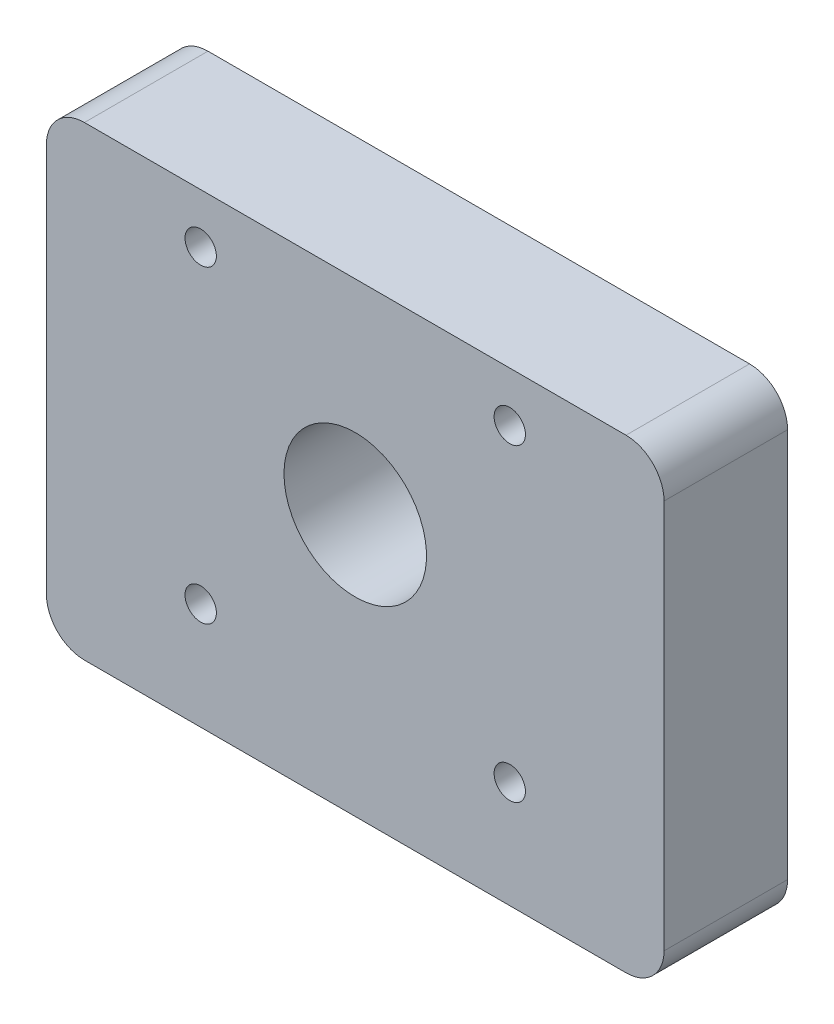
SolidWorks part; units mm, degrees
ref_plane "前视基准面" through (0, 0, 0) normal (0, 0, 1) x (1, 0, 0)
ref_plane "上视基准面" through (0, 0, 0) normal (0, 1, 0) x (1, 0, 0)
ref_plane "右视基准面" through (0, 0, 0) normal (1, 0, 0) x (0, 0, -1)
sketch "草图1" plane through (0, 0, 0) normal (0, 0, 1) x (1, 0, 0)
  line L1 (-32.5, -27.5) -> (32.5, -27.5)
  line L2 (-32.5, -27.5) -> (-32.5, 21.5)
  line L3 (-32.5, 21.5) -> (32.5, 21.5)
  line L4 (32.5, -27.5) -> (32.5, 21.5)
  point P0 (0, 0)
  dimension "D1" = 65
  dimension "D2" = 49
  dimension "D3" = 27.5
  dimension "D4" = 32.5
extrude "凸台-拉伸1" add sketch "草图1" along normal blind 13
sketch "草图2" plane through (0, 0, 0) normal (0, 0, -1) x (-1, 0, 0)
  line L0 (0, 0) -> (0, 50000) construction
  line L1 (32.5, -27.5) -> (-32.5, -27.5) construction
  circle A0 centre (0, 0) radius 7.5
  dimension "D2" = 15
  dimension "D1" = 27.5
extrude "切除-拉伸1" cut sketch "草图2" against normal blind 37.5
fillet "圆角1" radius 4 4 edges at (-32.5, 21.5, 6.5) (32.5, 21.5, 6.5) (32.5, -27.5, 6.5) (-32.5, -27.5, 6.5)
sketch "草图7" plane through (0, 0, 13) normal (0, 0, 1) x (1, 0, 0)
  line L0 (0, 0) -> (50000, 0) construction
  line L1 (0, 0) -> (0, 50000) construction
  line L2 (0, 0) -> (-35355.3391, 35355.3391) construction
  line L3 (0, 0) -> (35355.3391, 35355.3391) construction
  circle A0 centre (0, 0) radius 22.5 construction
  point P7 (-15.9099, 15.9099)
  point P12 (-15.9099, -15.9099)
  point P13 (15.9099, -15.9099)
  point P14 (15.9099, 15.9099)
  dimension "D1" = 45
  dimension "D2" = 45
  dimension "D3" = 45
sketch "草图8" plane through (0, 0, 13) normal (0, 0, 1) x (1, 0, 0)
  line L0 (0, 25.8236) -> (0, -25.2537) construction
  line L1 (-26.2866, 0) -> (29.9198, 0) construction
  line L2 (0, 0) -> (23.9395, 23.9395) construction
  circle A0 centre (0, 0) radius 23 construction
  circle A1 centre (16.2635, 16.2635) radius 2.0516
  circle A2 centre (16.2635, -16.2635) radius 2.0516
  circle A3 centre (-16.2635, -16.2635) radius 2.0516
  circle A4 centre (-16.2635, 16.2635) radius 2.0516
  point P19 (0, 0)
  dimension "D1" = 45
  dimension "D2" = 4
hole_wizard "M4 螺纹孔1" positions "3D草图2" profile "草图10" tap size "M4" standard "Gb"
sketch3d "3D草图2"
  point P0 (-16.2635, 16.2635, 13)
  point P3 (16.2635, 16.2635, 13)
  point P6 (16.2635, -16.2635, 13)
  point P9 (-16.2635, -16.2635, 13)
sketch "草图10" plane through (-16.2635, 16.2635, 13) normal (1, 0, 0) x (0, -1, 0)
  line L0 (0, 0) -> (0, 11.0914)
  line L1 (0, 11.0914) -> (1.65, 10.1)
  line L2 (1.65, 10.1) -> (1.65, 0)
  line L5 (1.65, 0) -> (0, 0)
  line L10 (0, 11.0914) -> (-1.65, 10.1) construction
  line L11 (0, -6.35) -> (0, 107.95) construction
  dimension "螺纹孔钻头直径" = 3.3
  dimension "螺纹孔钻头深度" = 10.1
  dimension "导头角度" = 118
